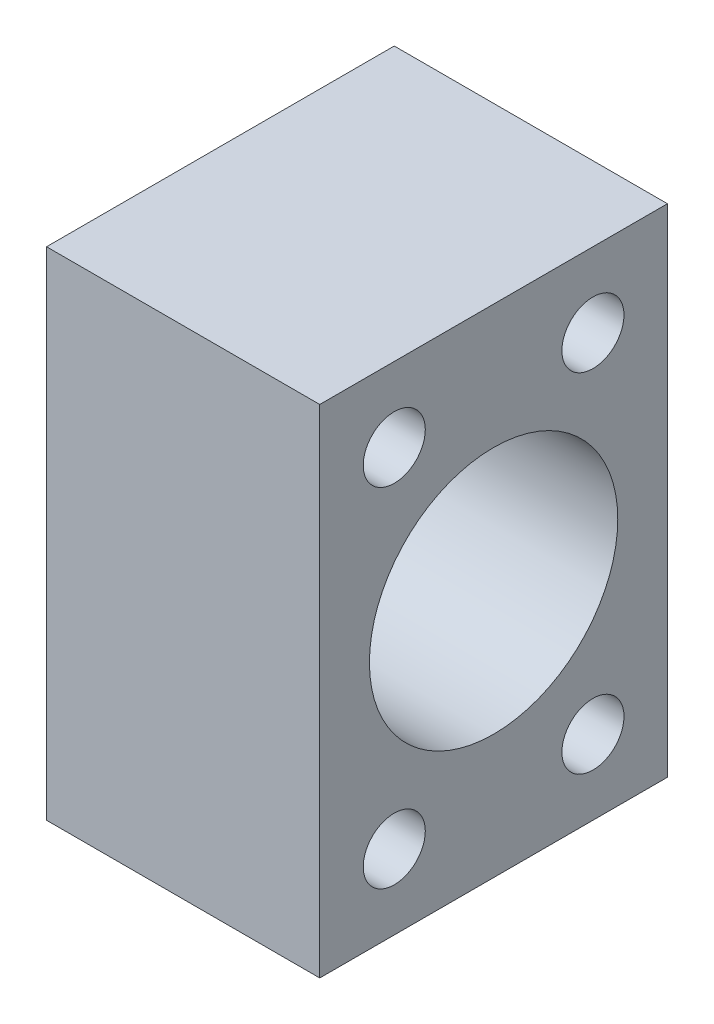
SolidWorks part; units mm, degrees
ref_plane "Front Plane" through (0, 0, 0) normal (0, 0, 1) x (1, 0, 0)
ref_plane "Top Plane" through (0, 0, 0) normal (0, 1, 0) x (1, 0, 0)
ref_plane "Right Plane" through (0, 0, 0) normal (1, 0, 0) x (0, 0, -1)
sketch "Sketch1" plane through (0, 0, 0) normal (1, 0, 0) x (0, 0, -1)
  line L0 (0, 0) -> (29.3627, 0) construction
  line L1 (-22.225, 31.75) -> (22.225, 31.75)
  line L2 (-22.225, 31.75) -> (-22.225, -31.75)
  line L3 (-22.225, -31.75) -> (22.225, -31.75)
  line L4 (0, 0) -> (0, -33.7369) construction
  line L5 (22.225, 31.75) -> (22.225, -31.75)
  circle A0 centre (0, 0) radius 15.875
  dimension "D3" = 31.75
  dimension "D1" = 63.5
  dimension "D4" = 22.225
extrude "Extrude1" add sketch "Sketch1" along normal mid plane 34.925
hole_wizard "3/8-16 Tapped Hole1" positions "3DSketch1" profile "Sketch2" tap size "3/8-16" standard "Ansi Inch"
sketch3d "3DSketch1"
  line L0 (17.4625, 31.75, 22.225) -> (17.4625, -31.75, 22.225) construction
  line L1 (17.4625, 31.75, -22.225) -> (17.4625, 31.75, 22.225) construction
  point P0 (17.4625, 22.225, 12.7)
  dimension "D1" = 9.525
  dimension "D2" = 9.525
sketch "Sketch2" plane through (17.4625, 22.225, 12.7) normal (0, 1, 0) x (0, 0, -1)
  line L0 (0, 0) -> (0, 34.925)
  line L1 (0, 34.925) -> (3.9687, 34.925)
  line L2 (3.9687, 34.925) -> (3.9687, 0)
  line L5 (3.9687, 0) -> (0, 0)
  line L11 (0, -6.35) -> (0, 107.95) construction
  dimension "Thru Tap Drill Dia." = 7.9375
  dimension "Thru Tap Drill Depth" = 34.925
mirror "Mirror1" about plane through (0, 0, 0) normal (0, 0, 1) of "3/8-16 Tapped Hole1"
mirror "Mirror2" about plane through (0, 0, 0) normal (0, 1, 0) of "Mirror1", "3/8-16 Tapped Hole1"
